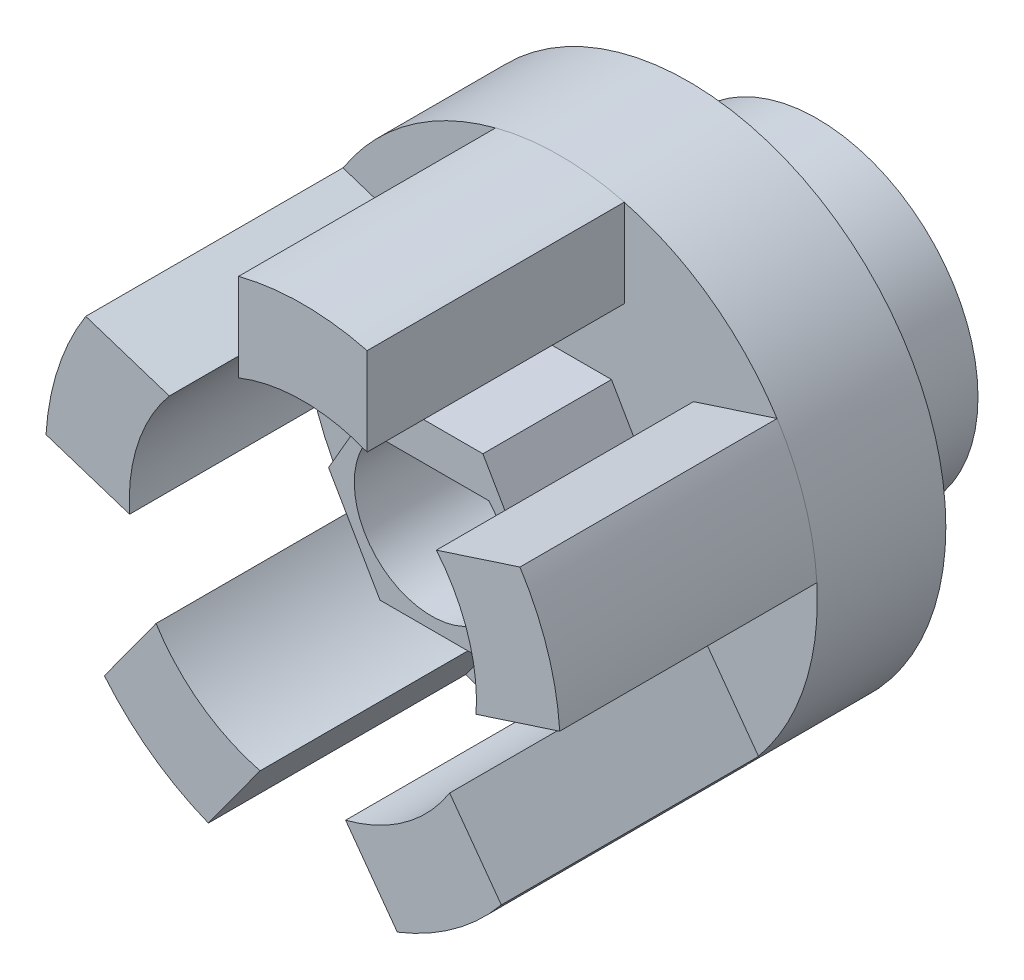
SolidWorks part; units mm, degrees
ref_plane "Front Plane" through (0, 0, 0) normal (0, 0, 1) x (1, 0, 0)
ref_plane "Top Plane" through (0, 0, 0) normal (0, 1, 0) x (1, 0, 0)
ref_plane "Right Plane" through (0, 0, 0) normal (1, 0, 0) x (0, 0, -1)
sketch "Sketch1" plane through (0, 0, 0) normal (0, 0, 1) x (1, 0, 0)
  circle A0 centre (0, 0) radius 3.175
  dimension "D1" = 6.35
extrude "Boss-Extrude1" add sketch "Sketch1" along normal blind 5.08
sketch "Sketch2" plane through (0, 0, 5.08) normal (0, 0, 1) x (1, 0, 0)
  line L1 (2.032, 0) -> (1.016, 1.7598)
  line L2 (1.016, 1.7598) -> (-1.016, 1.7598)
  line L3 (-1.016, 1.7598) -> (-2.032, 0)
  line L4 (-2.032, 0) -> (-1.016, -1.7598)
  line L5 (-1.016, -1.7598) -> (1.016, -1.7598)
  line L6 (1.016, -1.7598) -> (2.032, 0)
  circle A0 centre (0, 0) radius 1.7598 construction
  dimension "D1" = 4.064
extrude "Boss-Extrude2" add sketch "Sketch2" along normal blind 2.54
sketch "Sketch3" plane through (0, 0, 0) normal (0, 0, -1) x (-1, 0, 0)
  line L0 (-1.1359, 1.016) -> (1.1359, 1.016)
  arc A0 (-1.1359, 1.016) -> (1.1359, 1.016) centre (0, 0) ccw
  dimension "D1" = 3.048
  dimension "D2" = 1.016
extrude "Cut-Extrude1" cut sketch "Sketch3" against normal blind 7.62
sketch "Sketch5" plane through (0, 0, 5.08) normal (0, 0, 1) x (1, 0, 0)
  circle A0 centre (0, 0) radius 3.175
  circle A1 centre (0, 0) radius 5.08
  dimension "D1" = 6.35
  dimension "D2" = 10.16
extrude "Boss-Extrude3" add sketch "Sketch5" against normal blind 2.54
sketch "Sketch6" plane through (0, 0, 5.08) normal (0, 0, 1) x (1, 0, 0)
  line L0 (0, 0) -> (0, 5.702) construction
  line L1 (-1.27, 4.9215) -> (-1.27, 3.1851)
  line L2 (1.27, 4.9215) -> (1.27, 3.1851)
  line L3 (4.2881, 2.7287) -> (2.6368, 2.1921)
  line L4 (5.073, 0.313) -> (3.4217, -0.2236)
  line L5 (3.9202, -3.2351) -> (2.8996, -1.8303)
  line L6 (1.8653, -4.728) -> (0.8447, -3.3233)
  line L7 (-1.8653, -4.728) -> (-0.8447, -3.3233)
  line L8 (-3.9202, -3.2351) -> (-2.8996, -1.8303)
  line L9 (-5.073, 0.313) -> (-3.4217, -0.2236)
  line L10 (-4.2881, 2.7287) -> (-2.6368, 2.1921)
  arc A0 (1.27, 4.9215) -> (-1.27, 4.9215) centre (0, 0) ccw
  arc A1 (1.27, 3.1851) -> (-1.27, 3.1851) centre (0, 0) ccw
  arc A2 (5.073, 0.313) -> (4.2881, 2.7287) centre (0, 0) ccw
  arc A3 (3.4217, -0.2236) -> (2.6368, 2.1921) centre (0, 0) ccw
  arc A4 (1.8653, -4.728) -> (3.9202, -3.2351) centre (0, 0) ccw
  arc A5 (0.8447, -3.3233) -> (2.8996, -1.8303) centre (0, 0) ccw
  arc A6 (-3.9202, -3.2351) -> (-1.8653, -4.728) centre (0, 0) ccw
  arc A7 (-2.8996, -1.8303) -> (-0.8447, -3.3233) centre (0, 0) ccw
  arc A8 (-4.2881, 2.7287) -> (-5.073, 0.313) centre (0, 0) ccw
  arc A9 (-2.6368, 2.1921) -> (-3.4217, -0.2236) centre (0, 0) ccw
  point P25 (0, 0)
  dimension "D1" = 6.858
  dimension "D2" = 2.54
  dimension "D3" = 1.27
  dimension "D4" = 5
extrude "Boss-Extrude4" add sketch "Sketch6" along normal blind 5.08
